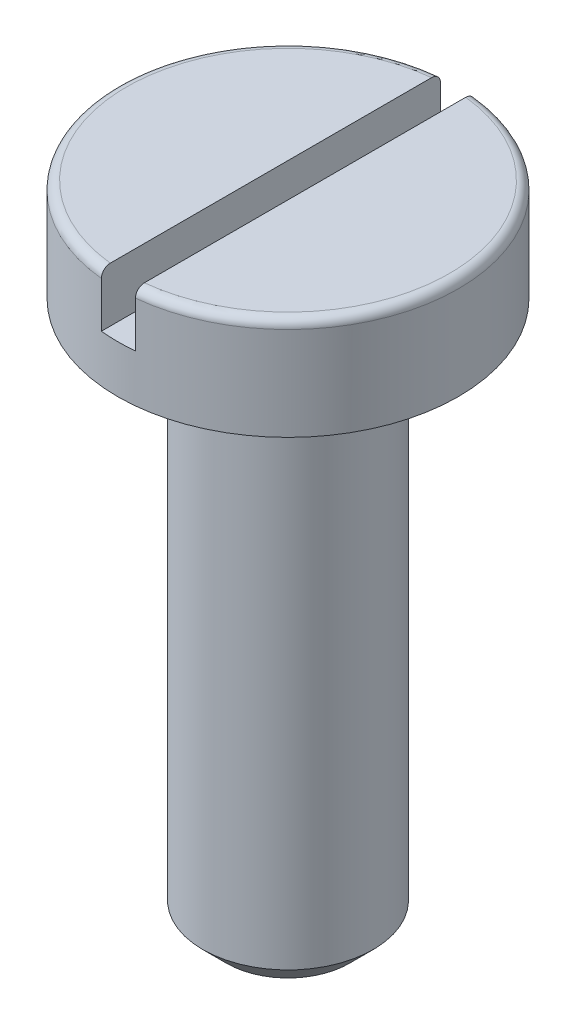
SolidWorks part; units mm, degrees
ref_plane "Face" through (0, 0, 0) normal (0, 0, 1) x (1, 0, 0)
ref_plane "Dessus" through (0, 0, 0) normal (0, 1, 0) x (1, 0, 0)
ref_plane "Droite" through (0, 0, 0) normal (1, 0, 0) x (0, 0, -1)
sketch "Esquisse1" plane through (0, 0, 0) normal (0, 1, 0) x (1, 0, 0)
  circle A0 centre (0, 0) radius 1.25
  dimension "Diamètre nominal" = 2.5
extrude "Base-Extrusion" add sketch "Esquisse1" against normal blind 8
chamfer "Chanfrein1" distance 0.35 angle 45 1 edges at (0, -8, 1.25)
sketch "Esquisse2" plane through (0, 0, 0) normal (0, 0, 1) x (1, 0, 0)
  line L0 (0, 1.5) -> (0, 0)
  line L2 (0, 0) -> (2.5, 0)
  line L4 (0, 1.5) -> (2.37, 1.5)
  line L5 (2.5, 0) -> (2.5, 1.37)
  line L7 (0, 1.3) -> (0, -8) construction
  line L8 (0, -7.65) -> (0, 0) construction
  line L9 (-0.9, -8) -> (0.9, -8) construction
  arc A0 (2.5, 1.37) -> (2.37, 1.5) centre (2.37, 1.37) ccw
  dimension "D2" = 0.13
  dimension "D1" = 5
  dimension "Hauteur tête" = 1.5
revolve "Boss.-Révol.1" add sketch "Esquisse2" angle 360 about L7
sketch "Esquisse3" plane through (0, 1.5, 0) normal (0, 1, 0) x (-1, 0, 0)
  line L0 (0, -2.5) -> (0, 2.5) construction
  line L1 (0.25, -2.5) -> (-0.25, -2.5)
  line L2 (0.25, 2.5) -> (-0.25, 2.5)
  line L3 (0.25, -2.5) -> (0.25, 2.5)
  line L4 (-0.25, -2.5) -> (-0.25, 2.5)
  circle A0 centre (0, 0) radius 2.5 construction
  dimension "Largeur fente" = 0.5
extrude "Enlèv. mat.-Extru.1" cut sketch "Esquisse3" against normal blind 0.8
